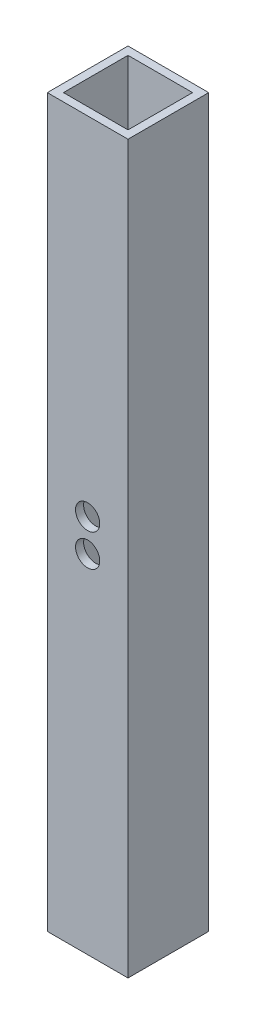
SolidWorks part; units mm, degrees
ref_plane "Front" through (0, 0, 0) normal (0, 0, 1) x (1, 0, 0)
ref_plane "Top" through (0, 0, 0) normal (0, 1, 0) x (1, 0, 0)
ref_plane "Right" through (0, 0, 0) normal (1, 0, 0) x (0, 0, -1)
sketch "草图1" plane through (0, 0, 0) normal (0, 1, 0) x (1, 0, 0)
  line L0 (1, 1) -> (9, 1)
  line L1 (0, 0) -> (10, 0)
  line L2 (0, 0) -> (0, 10)
  line L3 (0, 10) -> (10, 10)
  line L4 (10, 0) -> (10, 10)
  line L5 (9, 1) -> (9, 9)
  line L6 (1, 9) -> (9, 9)
  line L7 (1, 1) -> (1, 9)
  dimension "D1" = 10
  dimension "D2" = 10
  dimension "D3" = 1
extrude "凸台-拉伸1" add sketch "草图1" along normal blind 90
sketch "草图2" plane through (0, 0, 0) normal (0, 0, 1) x (1, 0, 0)
  line L0 (0, 90) -> (10, 90) construction
  line L1 (10, 90) -> (10, 0) construction
  line L2 (0, 90) -> (0, 0) construction
  circle A0 centre (5, 47) radius 1.5
  circle A1 centre (5, 43) radius 1.5
  dimension "D1" = 43
  dimension "D3" = 3
  dimension "D4" = 4
  dimension "D6" = 3
  dimension "D2" = 5
  dimension "D5" = 5
extrude "切除-拉伸1" cut sketch "草图2" against normal up to surface (10 mm away)
